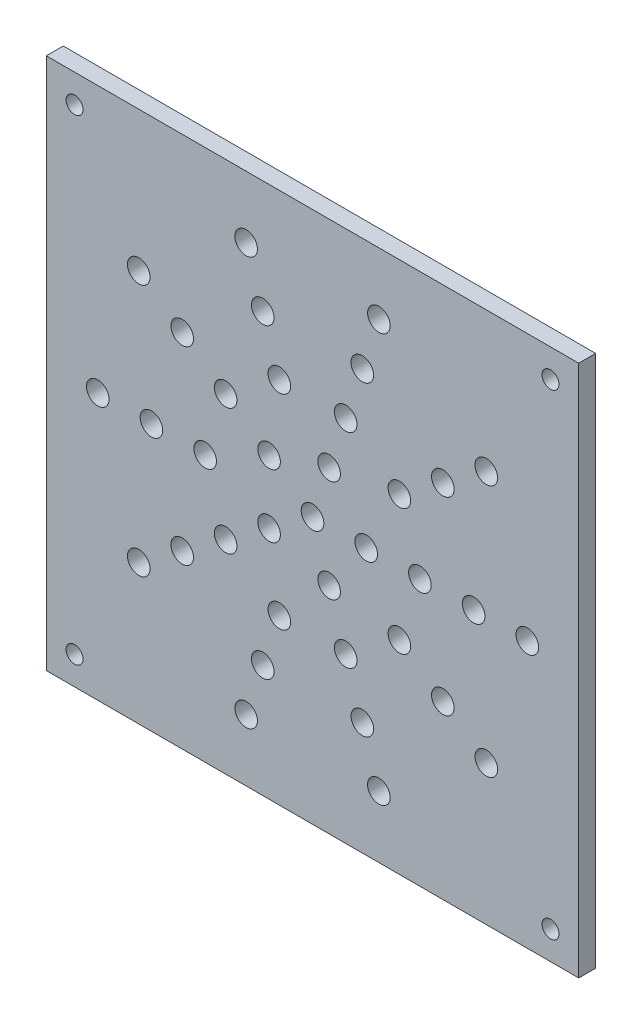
SolidWorks part; units mm, degrees
ref_plane "Plan de face" through (0, 0, 0) normal (0, 0, 1) x (1, 0, 0)
ref_plane "Plan de dessus" through (0, 0, 0) normal (0, 1, 0) x (1, 0, 0)
ref_plane "Plan de droite" through (0, 0, 0) normal (1, 0, 0) x (0, 0, -1)
sketch "Esquisse1" plane through (0, 0, 0) normal (0, 0, 1) x (1, 0, 0)
  line L0 (-5, -89.2) -> (-5, 5) construction
  line L1 (92.2, -89.2) -> (-8, -89.2) construction
  line L2 (92.2, 5) -> (-8, 5) construction
  line L3 (89.2, 5) -> (89.2, -89.2) construction
  line L4 (-5, -89.2) -> (-5, 5)
  line L5 (89.2, -89.2) -> (-5, -89.2)
  line L6 (89.2, 5) -> (-5, 5)
  line L7 (89.2, 5) -> (89.2, -89.2)
  circle A0 centre (0, 0) radius 1.5 construction
  circle A1 centre (0, -84.2) radius 1.5 construction
  circle A2 centre (84.2, -84.2) radius 1.5 construction
  circle A3 centre (84.2, 0) radius 1.5 construction
  circle A4 centre (0, 0) radius 1.5
  circle A5 centre (0, -84.2) radius 1.5
  circle A6 centre (84.2, -84.2) radius 1.5
  circle A7 centre (84.2, 0) radius 1.5
  circle A8 centre (42.1, -42.1) radius 2
  circle A9 centre (51.6, -42.1) radius 2
  circle A10 centre (61.1, -42.1) radius 2
  circle A11 centre (70.6, -42.1) radius 2
  circle A12 centre (80.1, -42.1) radius 2
  circle A14 centre (57.4713, -53.2679) radius 2
  circle A15 centre (65.157, -58.8519) radius 2
  circle A16 centre (72.8426, -64.4358) radius 2
  circle A17 centre (45.0357, -51.135) radius 2
  circle A18 centre (47.9713, -60.1701) radius 2
  circle A19 centre (50.907, -69.2051) radius 2
  circle A20 centre (53.8426, -78.2401) radius 2
  circle A22 centre (36.2287, -60.1701) radius 2
  circle A23 centre (33.293, -69.2051) radius 2
  circle A24 centre (30.3574, -78.2401) radius 2
  circle A25 centre (34.4143, -47.684) radius 2
  circle A26 centre (26.7287, -53.2679) radius 2
  circle A27 centre (19.043, -58.8519) radius 2
  circle A28 centre (11.3574, -64.4358) radius 2
  circle A30 centre (23.1, -42.1) radius 2
  circle A31 centre (13.6, -42.1) radius 2
  circle A32 centre (4.1, -42.1) radius 2
  circle A33 centre (34.4143, -36.516) radius 2
  circle A34 centre (26.7287, -30.9321) radius 2
  circle A35 centre (19.043, -25.3481) radius 2
  circle A36 centre (11.3574, -19.7642) radius 2
  circle A38 centre (36.2287, -24.0299) radius 2
  circle A39 centre (33.293, -14.9949) radius 2
  circle A40 centre (30.3574, -5.9599) radius 2
  circle A41 centre (45.0357, -33.065) radius 2
  circle A42 centre (47.9713, -24.0299) radius 2
  circle A43 centre (50.907, -14.9949) radius 2
  circle A44 centre (53.8426, -5.9599) radius 2
  circle A46 centre (57.4713, -30.9321) radius 2
  circle A47 centre (65.157, -25.3481) radius 2
  circle A48 centre (72.8426, -19.7642) radius 2
  circle A49 centre (49.7857, -36.516) radius 2
  circle A50 centre (49.7857, -47.684) radius 2
  circle A51 centre (39.1643, -51.135) radius 2
  circle A52 centre (32.6, -42.1) radius 2
  circle A53 centre (39.1643, -33.065) radius 2
  point P106 (42.1, -42.1)
  dimension "D1" = 5
  dimension "D2" = 10
extrude "Boss.-Extru.1" add sketch "Esquisse1" along normal blind 3 contours L7 L6 L4 L5 A48 A47 A46 A44 A43 A42 A41 A40 A39 A38 A36 A35 A34 A33 A32 A31 A30 A28 A27 A26 A25 A24 A23
